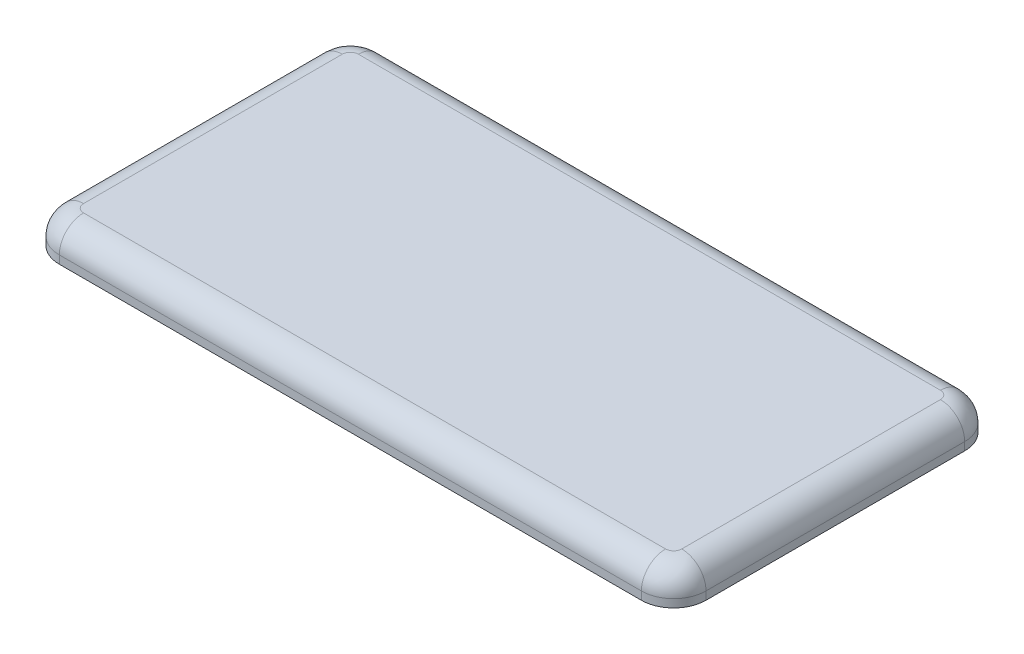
SolidWorks part; units mm, degrees
other "<10027-01-0000-00_abdeckkappe_80x40>-<Verrundung19>"
ref_plane "Ebene vorne" through (0, 0, 0) normal (0, 0, 1) x (1, 0, 0)
ref_plane "Ebene oben" through (0, 0, 0) normal (0, 1, 0) x (1, 0, 0)
ref_plane "Ebene rechts" through (0, 0, 0) normal (1, 0, 0) x (0, 0, -1)
inserted part "10027-01-0000-00_abdeckkappe_80x40"
other "Fläche verschieben1" parameters "D1"=90
